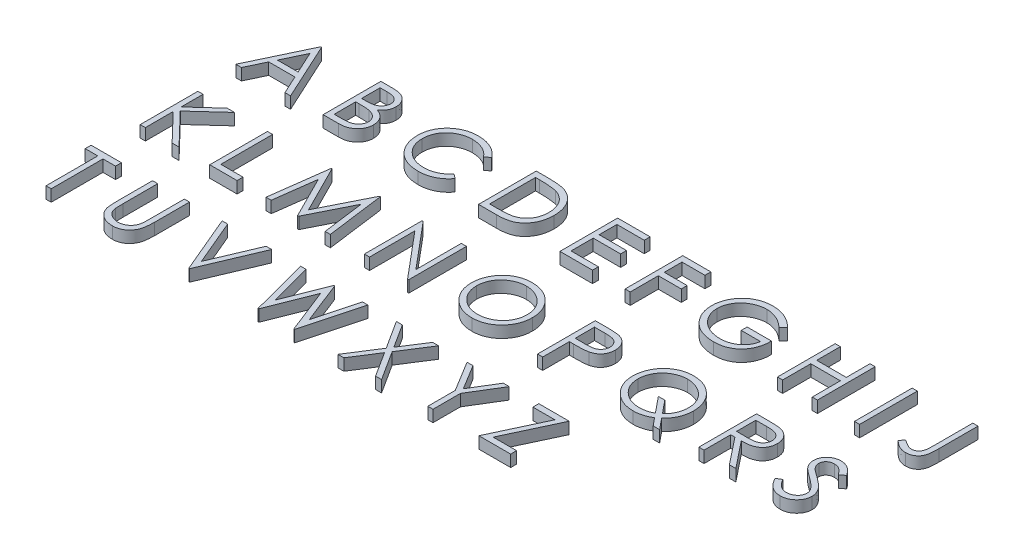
SolidWorks part; units mm, degrees
ref_plane "Front Plane" through (0, 0, 0) normal (0, 0, 1) x (1, 0, 0)
ref_plane "Top Plane" through (0, 0, 0) normal (0, 1, 0) x (1, 0, 0)
ref_plane "Right Plane" through (0, 0, 0) normal (1, 0, 0) x (0, 0, -1)
sketch "Sketch1" plane through (0, 0, 0) normal (0, 1, 0) x (1, 0, 0)
  text T0 "A B C D E F G H I J   K L M N O P Q R S   T U V W X Y Z" font "Century Gothic" height in points 56
extrude "Boss-Extrude1" add sketch "Sketch1" along normal blind 3
